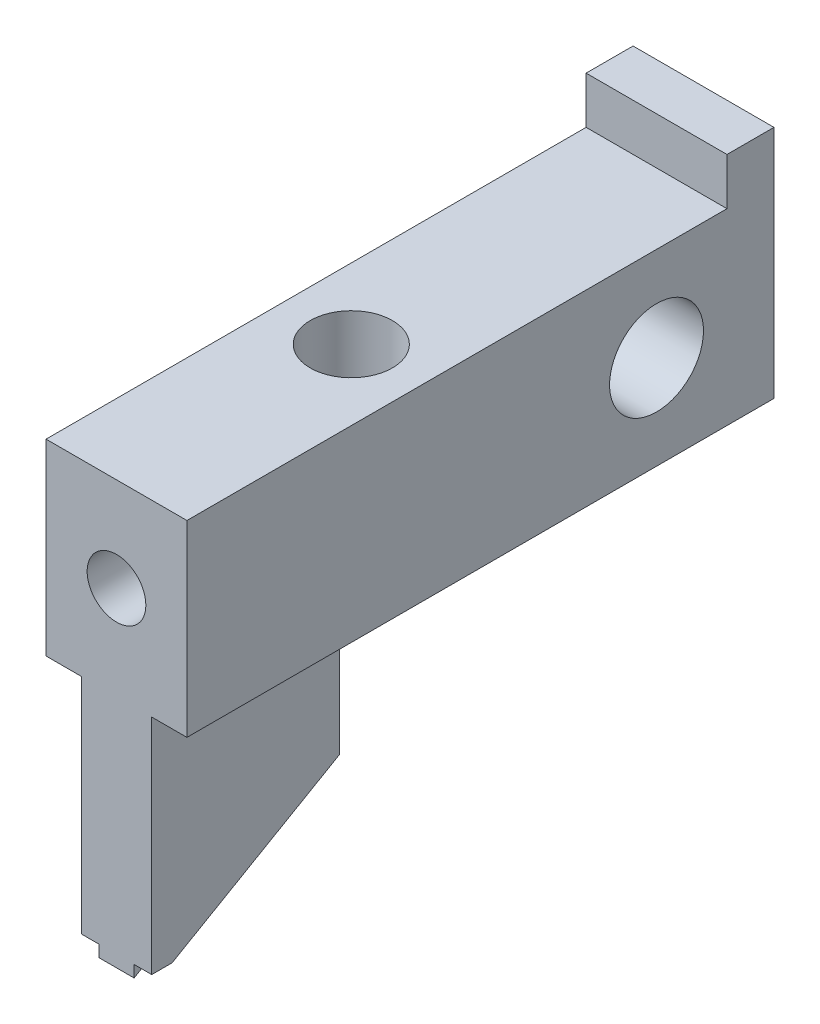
SolidWorks part; units mm, degrees
ref_plane "前视基准面" through (0, 0, 0) normal (0, 0, 1) x (1, 0, 0)
ref_plane "上视基准面" through (0, 0, 0) normal (0, 1, 0) x (1, 0, 0)
ref_plane "右视基准面" through (0, 0, 0) normal (1, 0, 0) x (0, 0, -1)
sketch "草图1" plane through (0, 0, 0) normal (0, 0, 1) x (1, 0, 0)
  line L0 (0, 20) -> (6, 20)
  line L1 (4.5, 10) -> (6, 10)
  line L2 (3.75, 0.5) -> (4.5, 0.5)
  line L3 (0, 10) -> (0, 20)
  line L4 (6, 10) -> (6, 20)
  line L5 (2.25, 0) -> (3.75, 0)
  line L6 (1.5, 0.5) -> (2.25, 0.5)
  line L7 (0, 10) -> (1.5, 10)
  line L8 (4.5, 0.5) -> (4.5, 10)
  line L9 (1.5, 0.5) -> (1.5, 10)
  line L10 (3.75, 0) -> (3.75, 0.5)
  line L11 (2.25, 0) -> (2.25, 0.5)
extrude "凸台-拉伸1" add sketch "草图1" along normal blind 25
sketch "草图2" plane through (0, 0, 25) normal (0, 0, 1) x (1, 0, 0)
  circle A0 centre (3, 14) radius 1.25
extrude "切除-拉伸1" cut sketch "草图2" against normal blind 15
sketch "草图3" plane through (6, 0, 0) normal (1, 0, 0) x (0, 0, -1)
  line L0 (-25, 0) -> (-25, 18)
  line L1 (-25, 0) -> (-17, 4.6188)
  line L2 (-17, 10) -> (0, 10)
  line L3 (-25, 18) -> (-2, 18)
  line L4 (0, 10) -> (0, 20)
  line L5 (-17, 4.6188) -> (-17, 10)
  line L6 (-2, 18) -> (-2, 20)
  line L7 (-2, 20) -> (0, 20)
  circle A0 centre (-5, 14) radius 2
extrude "切除-拉伸2" cut sketch "草图3" against normal blind 15 flip side to cut
sketch "草图4" plane through (0, 18, 0) normal (0, 1, 0) x (1, 0, 0)
  circle A0 centre (3, -15) radius 1.75
extrude "切除-拉伸3" cut sketch "草图4" against normal blind 3
